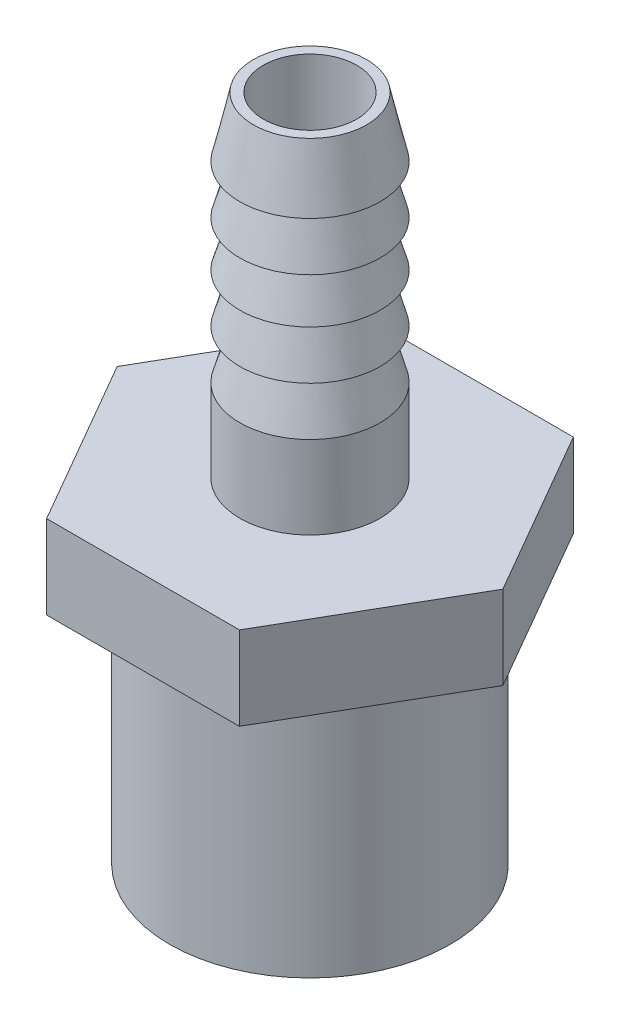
SolidWorks part; units mm, degrees
ref_plane "Front" through (0, 0, 0) normal (0, 0, 1) x (1, 0, 0)
ref_plane "Top" through (0, 0, 0) normal (0, 1, 0) x (1, 0, 0)
ref_plane "Right" through (0, 0, 0) normal (1, 0, 0) x (0, 0, -1)
sketch "Sketch1" plane through (0, 0, 0) normal (0, 1, 0) x (1, 0, 0)
  line L1 (-7.3301, -12.7013) -> (7.3346, -12.6987)
  line L2 (7.3346, -12.6987) -> (14.6647, 0.0026)
  line L3 (14.6647, 0.0026) -> (7.3301, 12.7013)
  line L4 (7.3301, 12.7013) -> (-7.3346, 12.6987)
  line L5 (-7.3346, 12.6987) -> (-14.6647, -0.0026)
  line L6 (-14.6647, -0.0026) -> (-7.3301, -12.7013)
  circle A0 centre (0, 0) radius 12.7 construction
  dimension "D1" = 25.4
extrude "Boss-Extrude1" add sketch "Sketch1" along normal blind 6.35
sketch "Sketch2" plane through (0, 0, 0) normal (0, 0, 1) x (1, 0, 0)
  line L0 (0, -18.5583) -> (0, 42.9723) construction
  line L1 (5.334, 12.6407) -> (5.334, 6.35)
  line L2 (-7.3301, 6.35) -> (7.3346, 6.35) construction
  line L3 (3.556, 49.9222) -> (3.556, -5.6845) construction
  line L4 (3.556, 31.75) -> (4.3061, 31.75)
  line L5 (4.3061, 31.75) -> (5.334, 27.1996)
  line L6 (5.334, 27.1996) -> (4.3061, 27.1996)
  line L7 (4.3061, 27.1996) -> (5.334, 23.4945)
  line L8 (5.334, 23.4945) -> (4.3061, 23.4945)
  line L9 (4.3061, 23.4945) -> (5.334, 20.0509)
  line L10 (5.334, 20.0509) -> (4.3061, 20.0509)
  line L11 (4.3061, 20.0509) -> (5.334, 16.3458)
  line L12 (5.334, 16.3458) -> (4.3061, 16.3458)
  line L13 (4.3061, 16.3458) -> (5.334, 12.6407)
  line L14 (3.556, 31.75) -> (3.556, 6.35)
  line L15 (3.556, 6.35) -> (5.334, 6.35)
revolve "Revolve1" add sketch "Sketch2" angle 360 about L0
sketch "Sketch3" plane through (0, 0, 0) normal (0, -1, 0) x (1, 0, 0)
  circle A0 centre (0, 0) radius 10.668
  circle A1 centre (0, 0) radius 7.8994
  dimension "D1" = 21.336
  dimension "D2" = 15.7988
extrude "Boss-Extrude2" add sketch "Sketch3" along normal blind 19.05
